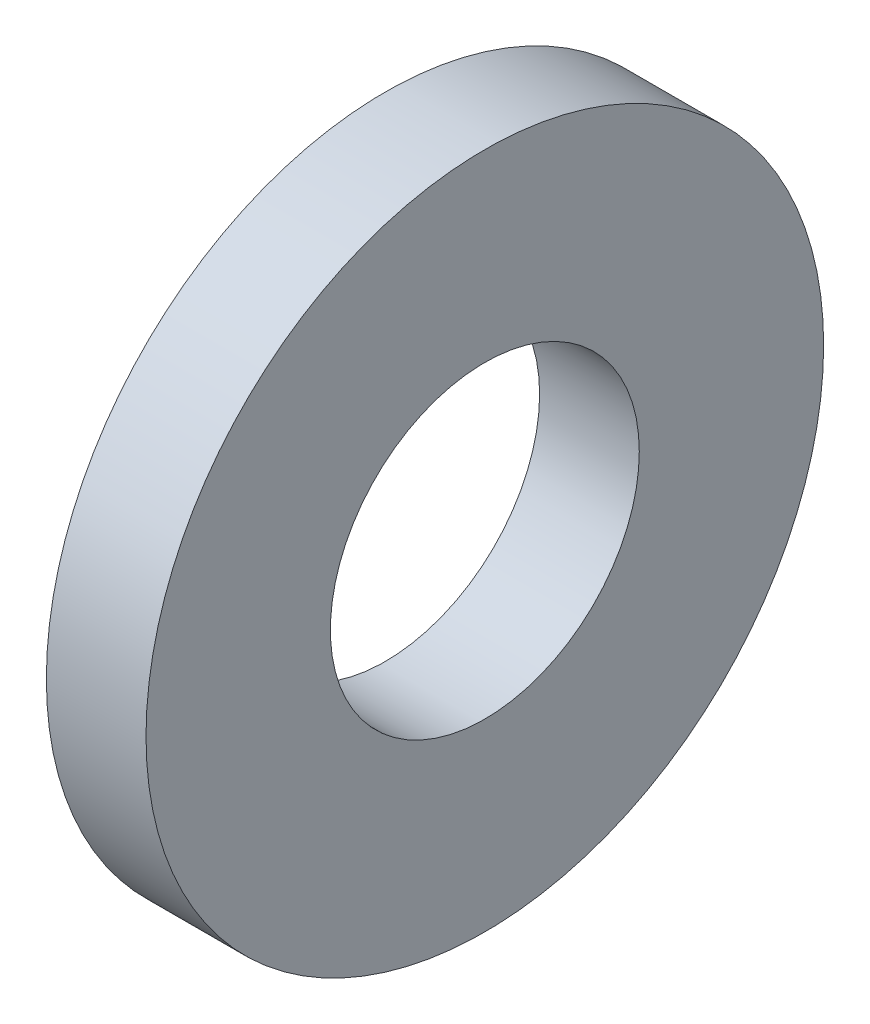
SolidWorks part; units mm, degrees
ref_plane "Plane1" through (0, 0, 0) normal (0, 0, 1) x (1, 0, 0)
ref_plane "Plane2" through (0, 0, 0) normal (0, 1, 0) x (1, 0, 0)
ref_plane "Plane3" through (0, 0, 0) normal (1, 0, 0) x (0, 0, -1)
other "Configuration Table"
sketch "Sketch1" plane through (0, 0, 0) normal (1, 0, 0) x (0, 0, -1)
  circle A0 centre (0, 0) radius 15.5
  circle A1 centre (0, 0) radius 34
  dimension "InsideDia" = 31
  dimension "OutsideDia" = 68
extrude "Base-Extrude" add sketch "Sketch1" along normal blind 10
